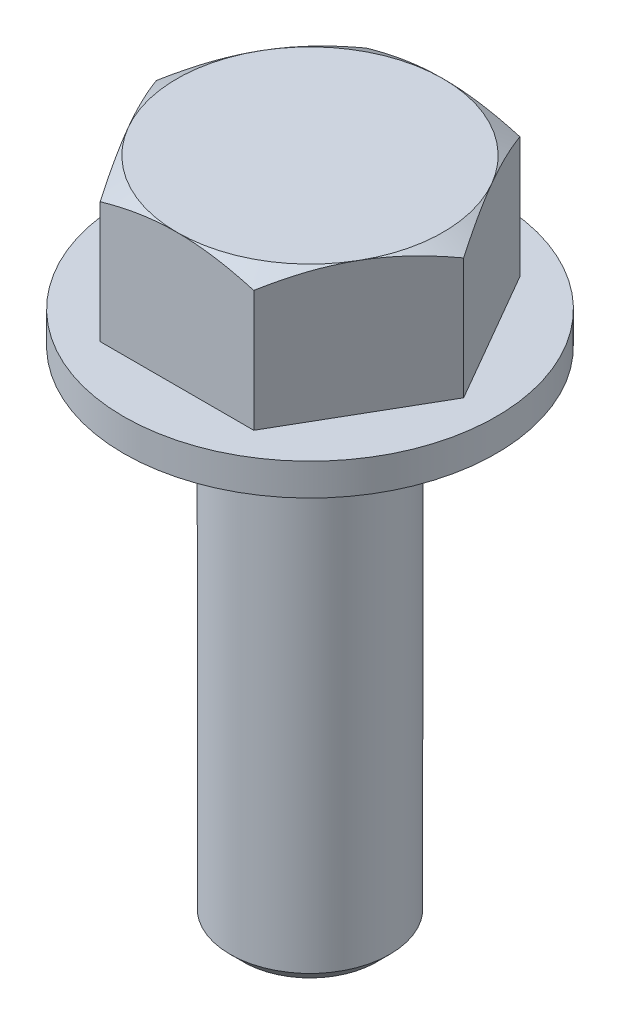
SolidWorks part; units mm, degrees
ref_plane "Plan de face" through (0, 0, 0) normal (0, 0, 1) x (1, 0, 0)
ref_plane "Plan de dessus" through (0, 0, 0) normal (0, 1, 0) x (1, 0, 0)
ref_plane "Plan de droite" through (0, 0, 0) normal (1, 0, 0) x (0, 0, -1)
sketch "Esquisse1" plane through (0, 0, 0) normal (0, 1, 0) x (1, 0, 0)
  line L1 (5.7735, 0) -> (2.8868, 5)
  line L2 (2.8868, 5) -> (-2.8868, 5)
  line L3 (-2.8868, 5) -> (-5.7735, 0)
  line L4 (-5.7735, 0) -> (-2.8868, -5)
  line L5 (-2.8868, -5) -> (2.8868, -5)
  line L6 (2.8868, -5) -> (5.7735, 0)
  circle A0 centre (0, 0) radius 5 construction
  dimension "D1" = 10
extrude "Extrusion1" add sketch "Esquisse1" along normal mid plane 5
sketch "Esquisse2" plane through (0, 0, 0) normal (1, 0, 0) x (0, 0, -1)
  line L0 (2, 4.2321) -> (8, 4.2321)
  line L1 (8, 4.2321) -> (8, 0.7679)
  line L2 (8, 0.7679) -> (2, 4.2321)
  line L3 (0, 9.378) -> (0, -1.3286) construction
  dimension "D1" = 30
  dimension "D2" = 3
revolve "Enlèvement de matière-Révolution4" cut sketch "Esquisse2" angle 360 about L3
sketch "Esquisse3" plane through (0, -2.5, 0) normal (0, -1, 0) x (1, 0, 0)
  circle A0 centre (0, 0) radius 3
  dimension "D1" = 6
extrude "Extrusion2" add sketch "Esquisse3" along normal blind 20
chamfer "Chanfrein1" distance 0.5 angle 45 1 edges at (0, -22.5, -3)
sketch "Esquisse4" plane through (0, 0, 0) normal (0, 0, 1) x (1, 0, 0)
  line L0 (0, 0) -> (0, -11.4545) construction
  line L1 (2.8868, -2.5) -> (5.7735, -2.5) construction
  line L2 (3.5, -2.5) -> (7, -2.5)
  line L3 (3.5, -2.5) -> (3.5, -3.7)
  line L4 (3.5, -3.7) -> (7, -3.7)
  line L5 (7, -2.5) -> (7, -3.7)
  dimension "D1" = 14
  dimension "D2" = 1.2
  dimension "D3" = 7
revolve "Révolution1" add sketch "Esquisse4" angle 360 about L0
